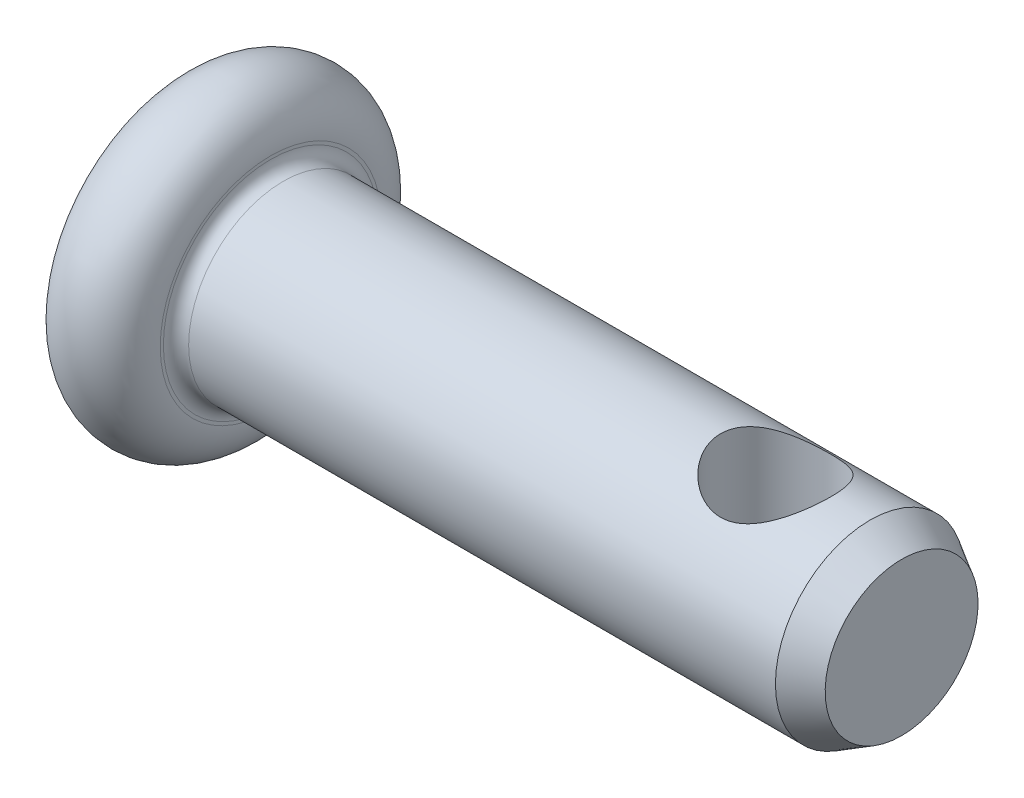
SolidWorks part; units mm, degrees
ref_plane "Front" through (0, 0, 0) normal (0, 0, 1) x (1, 0, 0)
ref_plane "Top" through (0, 0, 0) normal (0, 1, 0) x (1, 0, 0)
ref_plane "Right" through (0, 0, 0) normal (1, 0, 0) x (0, 0, -1)
other "Configuration Table"
sketch "Sketch1" plane through (0, 0, 0) normal (0, 0, 1) x (1, 0, 0)
  line L0 (11.5, 0) -> (0, 0)
  line L1 (0, 0) -> (0, 1.75)
  line L2 (11.5, 0) -> (11.5, 1.2113)
  line L3 (11.5, 1.2113) -> (11, 1.5)
  line L4 (11, 1.5) -> (1.5, 1.5)
  line L5 (1.5, 1.5) -> (1.5, 1.75)
  line L6 (-19.83, 0) -> (9.2989, 0) construction
  arc A0 (0, 1.75) -> (1.5, 1.75) centre (0.75, 1.75) cw
  dimension "l" = 10
  dimension "k" = 1.5
  dimension "d" = 3
  dimension "D4" = 30
  dimension "c" = 0.5
  dimension "dk" = 5
revolve "BaseBody" add sketch "Sketch1" angle 360 about L6
fillet "Chamfer1" radius 0.2 1 edges at (1.5, -1.5, 0)
sketch "Sketch2" plane through (0, 0, 0) normal (0, 1, 0) x (1, 0, 0)
  line L0 (-19.83, 0) -> (9.2989, 0) construction
  line L1 (11.5, -1.2113) -> (11.5, 1.2113) construction
  circle A0 centre (9.5, 0) radius 0.87
  dimension "D2" = 2
  dimension "d1" = 1.74
extrude "Hole" cut sketch "Sketch2" against normal through all and the other way through all
